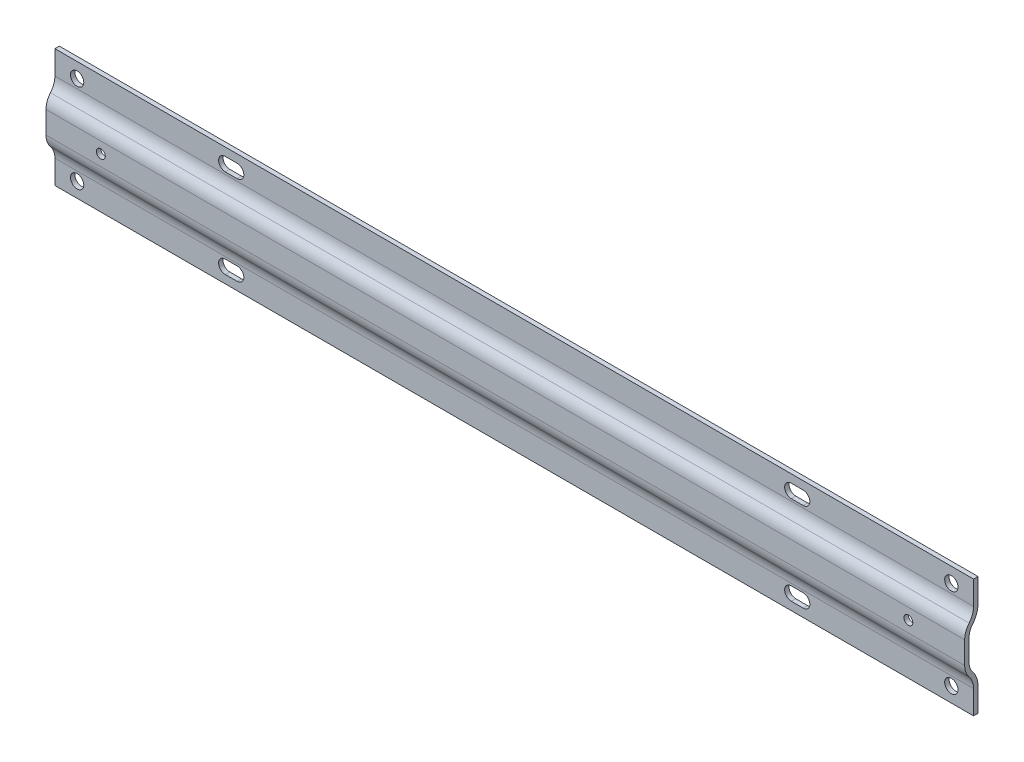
SolidWorks part; units mm, degrees
ref_plane "Спереди" through (0, 0, 0) normal (0, 0, 1) x (1, 0, 0)
ref_plane "Сверху" through (0, 0, 0) normal (0, 1, 0) x (1, 0, 0)
ref_plane "Справа" through (0, 0, 0) normal (1, 0, 0) x (0, 0, -1)
sketch "Эскиз1" plane through (0, 0, 0) normal (1, 0, 0) x (0, 0, -1)
  line L0 (9, -40) -> (9, -24)
  line L1 (0, -40) -> (9, -40) construction
  line L2 (0, -40) -> (0, 40) construction
  line L3 (0, 40) -> (9, 40) construction
  line L4 (9, -40) -> (9, 40) construction
  line L5 (9, -40) -> (6, -40)
  line L6 (6, -40) -> (6, -24)
  line L7 (0, 7.5) -> (0, -7.5)
  line L8 (0, -7.5) -> (6, -24) construction
  line L9 (0, 0) -> (9, 0) construction
  line L10 (6, 40) -> (6, 24)
  line L11 (6, 40) -> (9, 40)
  line L12 (3, -7.5) -> (3, 7.5)
  line L13 (9, 24) -> (9, 40)
  arc A0 (6, -24) -> (3, -15.75) centre (-6.8437, -24) ccw
  arc A1 (3, -15.75) -> (0, -7.5) centre (12.8438, -7.5) cw
  arc A2 (6, 24) -> (3, 15.75) centre (-6.8438, 24) cw
  arc A3 (3, 15.75) -> (0, 7.5) centre (12.8438, 7.5) ccw
  arc A4 (9, -24) -> (5.2993, -13.823) centre (-6.8437, -24) ccw
  arc A5 (5.2993, -13.823) -> (3, -7.5) centre (12.8438, -7.5) cw
  arc A6 (9, 24) -> (5.2993, 13.823) centre (-6.8438, 24) cw
  arc A7 (5.2993, 13.823) -> (3, 7.5) centre (12.8438, 7.5) ccw
  point P27 (3, 0)
  dimension "D1" = 9
  dimension "D2" = 80
  dimension "D3" = 40
  dimension "D5" = 16
  dimension "D6" = 7.5
  dimension "D7" = 3
extrude "Бобышка-Вытянуть1" add sketch "Эскиз1" against normal blind 620
sketch "Эскиз3" plane through (0, 0, -6) normal (0, 0, 1) x (1, 0, 0)
  line L0 (-310, 40) -> (-310, 144.107) construction
  line L1 (-620, 40) -> (0, 40) construction
  line L2 (0, 0) -> (-620, 0) construction
  line L3 (0, 40) -> (0, 24) construction
  line L4 (-15, 30) -> (-247.8896, 30) construction
  line L5 (-123, 30) -> (-115, 30) construction
  line L6 (-123, 34.5) -> (-115, 34.5)
  line L7 (-123, 25.5) -> (-115, 25.5)
  line L8 (-620, 7.5) -> (-620, -7.5) construction
  line L9 (0, -24) -> (0, -40) construction
  line L10 (-620, -24) -> (-620, -40) construction
  line L11 (-123, -30) -> (-115, -30) construction
  line L12 (-123, -34.5) -> (-115, -34.5)
  line L13 (-123, -25.5) -> (-115, -25.5)
  line L14 (-497, 30) -> (-505, 30) construction
  line L15 (-497, 34.5) -> (-505, 34.5)
  line L16 (-497, 25.5) -> (-505, 25.5)
  line L17 (-497, -30) -> (-505, -30) construction
  line L18 (-497, -34.5) -> (-505, -34.5)
  line L19 (-497, -25.5) -> (-505, -25.5)
  circle A0 centre (-15, 30) radius 4.5
  arc A1 (-123, 34.5) -> (-123, 25.5) centre (-123, 30) ccw
  arc A2 (-115, 25.5) -> (-115, 34.5) centre (-115, 30) ccw
  circle A3 centre (-38, 0) radius 3
  circle A4 centre (-583, 0) radius 3
  arc A5 (-123, -34.5) -> (-123, -25.5) centre (-123, -30) cw
  arc A6 (-115, -25.5) -> (-115, -34.5) centre (-115, -30) cw
  circle A7 centre (-15, -30) radius 4.5
  arc A8 (-497, 34.5) -> (-497, 25.5) centre (-497, 30) cw
  arc A9 (-505, 25.5) -> (-505, 34.5) centre (-505, 30) cw
  arc A10 (-497, -34.5) -> (-497, -25.5) centre (-497, -30) ccw
  arc A11 (-505, -25.5) -> (-505, -34.5) centre (-505, -30) ccw
  circle A12 centre (-605, 30) radius 4.5
  circle A13 centre (-605, -30) radius 4.5
  point P14 (-119, 30)
  point P32 (-119, -30)
  point P41 (-501, 30)
  point P48 (-501, -30)
  dimension "D3" = 9
  dimension "D7" = 6
  dimension "D9" = 6
  dimension "D1" = 30
  dimension "D2" = 15
  dimension "D4" = 9
  dimension "D5" = 8
  dimension "D6" = 38
  dimension "D8" = 37
  dimension "D10" = 104
extrude "Вырез-Вытянуть1" cut sketch "Эскиз3" against normal through all and the other way through all
move or copy body "Тело-Переместить/Копировать2" [suppressed] bodies to move or copy 104
move or copy body "Тело-Переместить/Копировать1" [suppressed] bodies to move or copy 104 105 106 107 108 109 110
